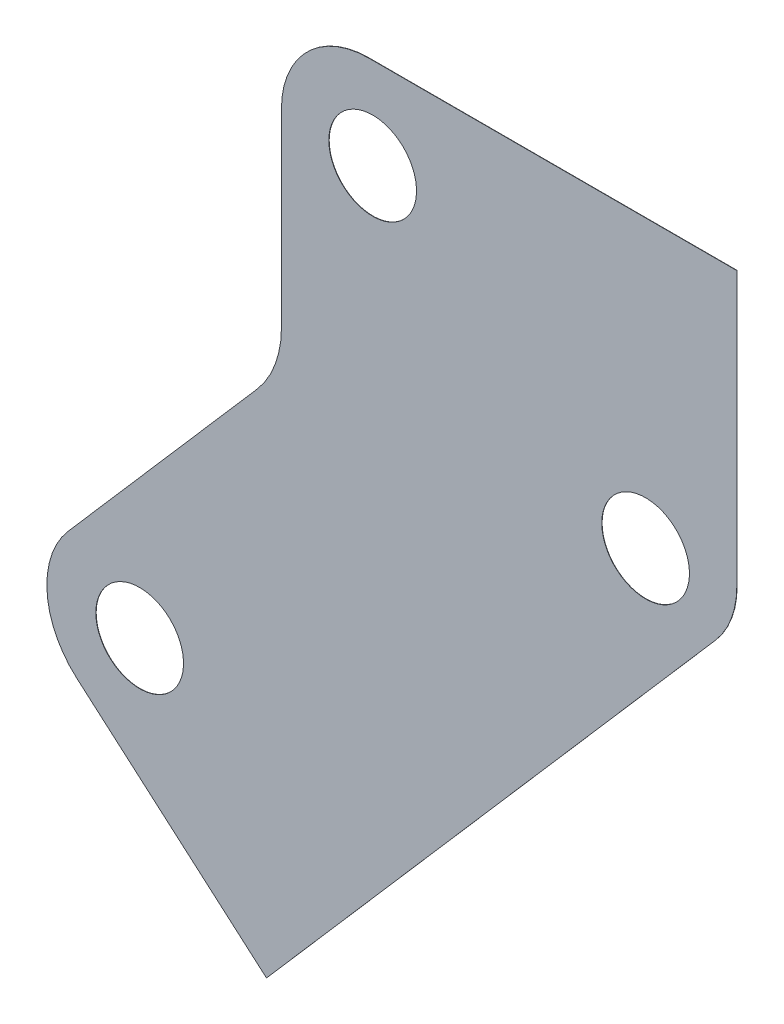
SolidWorks part; units mm, degrees
ref_plane "Front" through (0, 0, 0) normal (0, 0, 1) x (1, 0, 0)
ref_plane "Top" through (0, 0, 0) normal (0, 1, 0) x (1, 0, 0)
ref_plane "Right" through (0, 0, 0) normal (1, 0, 0) x (0, 0, -1)
sketch "Sketch1" plane through (0, 0, 0) normal (0, 0, 1) x (1, 0, 0)
  line L12 (-702.3856, -82.7525) -> (-665.8252, -40.6531)
  line L13 (-717.8237, -69.3456) -> (-702.3856, -82.7525)
  line L14 (-703.1581, -41.6115) -> (-718.5302, -59.3125)
  line L15 (-701.167, -20.8199) -> (-701.167, -36.2821)
  line L16 (-664.083, -13.7079) -> (-694.055, -13.7079)
  line L17 (-664.083, -35.9898) -> (-664.083, -13.7079)
  line L18 (-702.3856, -82.7525) -> (-665.8252, -40.6531)
  line L19 (-717.8237, -69.3456) -> (-702.3856, -82.7525)
  line L20 (-703.1581, -41.6115) -> (-718.5302, -59.3125)
  line L21 (-701.167, -20.8199) -> (-701.167, -36.2821)
  line L22 (-664.083, -13.7079) -> (-694.055, -13.7079)
  line L23 (-664.083, -35.9898) -> (-664.083, -13.7079)
  arc A8 (-718.5302, -59.3125) -> (-717.8237, -69.3456) centre (-713.1604, -63.9758) ccw
  arc A9 (-703.1581, -41.6115) -> (-701.167, -36.2821) centre (-709.295, -36.2821) ccw
  arc A10 (-694.055, -13.7079) -> (-701.167, -20.8199) centre (-694.055, -20.8199) ccw
  arc A11 (-665.8252, -40.6531) -> (-664.083, -35.9898) centre (-671.195, -35.9898) ccw
  arc A12 (-718.5302, -59.3125) -> (-717.8237, -69.3456) centre (-713.1604, -63.9758) ccw
  arc A13 (-703.1581, -41.6115) -> (-701.167, -36.2821) centre (-709.295, -36.2821) ccw
  arc A14 (-694.055, -13.7079) -> (-701.167, -20.8199) centre (-694.055, -20.8199) ccw
  arc A15 (-665.8252, -40.6531) -> (-664.083, -35.9898) centre (-671.195, -35.9898) ccw
  dimension "D1" = 0.508
extrude "Boss-Extrude1" add sketch "Sketch1" along normal blind 0.0254 separate body
hole_wizard "Hole1" positions "Point_Sketch" profile "Profil_Sketch" hole size "Ø0.15" standard "ISO"
sketch "Point_Sketch" plane through (-690.0832, -10.5362, 0) normal (0, 0, 1) x (-1, 0, 0)
  point P0 (3.6543, 10.6011)
  point P2 (22.6293, 53.408)
  point P4 (-18.5707, 26.4761)
sketch "Profil_Sketch" plane through (-693.7375, -21.1374, 0) normal (1, 0, 0) x (0, 1, 0)
  line L0 (0, 0) -> (0, 0.0254)
  line L1 (0, 0.0254) -> (3.5687, 0.0254)
  line L2 (3.5687, 0.0254) -> (3.5687, 0)
  line L5 (3.5687, 0) -> (0, 0)
  line L11 (0, -6.35) -> (0, 107.95) construction
  dimension "Diameter" = 7.1374
  dimension "Thru Hole Depth" = 0.0254
other "usin_DL090_.25-20x3-SHCS<1>"
